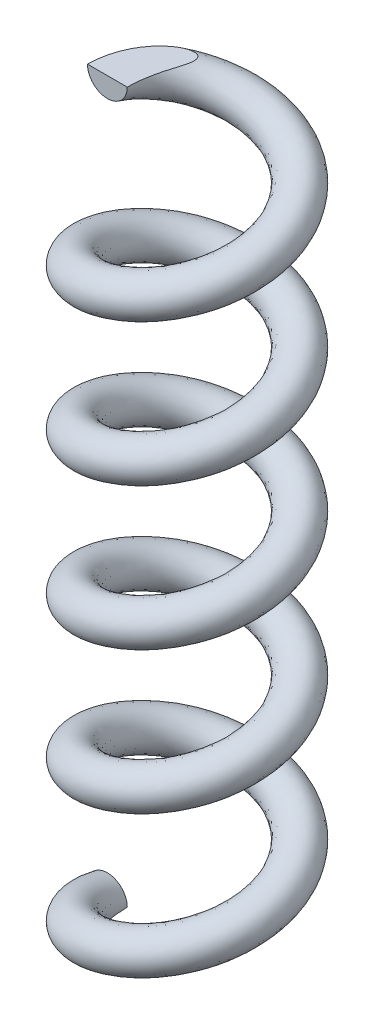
SolidWorks part; units mm, degrees
ref_plane "Front Plane" through (0, 0, 0) normal (0, 0, 1) x (1, 0, 0)
ref_plane "Top Plane" through (0, 0, 0) normal (0, 1, 0) x (1, 0, 0)
ref_plane "Right Plane" through (0, 0, 0) normal (1, 0, 0) x (0, 0, -1)
sketch "Sketch1" plane through (0, 0, 0) normal (0, 0, 1) x (1, 0, 0)
  line L1 (-24, -71.5) -> (-38, -71.5) construction
  circle A0 centre (-38, -71.5) radius 3.5
  dimension "D3" = 7
  dimension "D2" = 14
sketch "Sketch5" plane through (0, 0, 0) normal (0, 0, 1) x (1, 0, 0)
  line L0 (-24, -71.5) -> (-24, 53.3742)
  line L3 (-29, 53.3742) -> (-19, 53.3742) construction
  point P3 (0, 0)
  point P4 (0, 0)
  point P5 (0, 0)
  point P7 (0, 0)
sweep "Sweep3" add profiles "Sketch1" path "Sketch5" parameters "D4"=1800
ref_plane "Plane3" through (0, 53.3742, 0) normal (0, 1, 0) x (1, 0, 0)
ref_plane "Plane4" through (0, -71.5, 0) normal (0, 1, 0) x (1, 0, 0)
other "SurfaceCut1"
other "SurfaceCut2"
